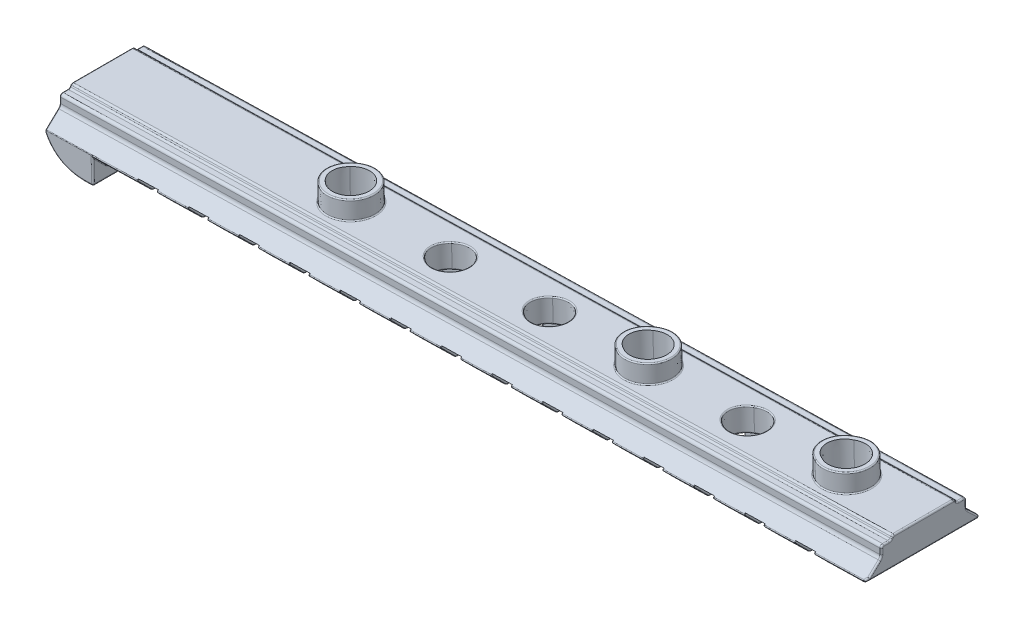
SolidWorks part; units mm, degrees
ref_plane "Front Plane" through (0, 0, 0) normal (0, 0, 1) x (1, 0, 0)
ref_plane "Top Plane" through (0, 0, 0) normal (0, 1, 0) x (1, 0, 0)
ref_plane "Right Plane" through (0, 0, 0) normal (1, 0, 0) x (0, 0, -1)
body saved out of another part "Stock-TDI ARMS IDIT-1"
